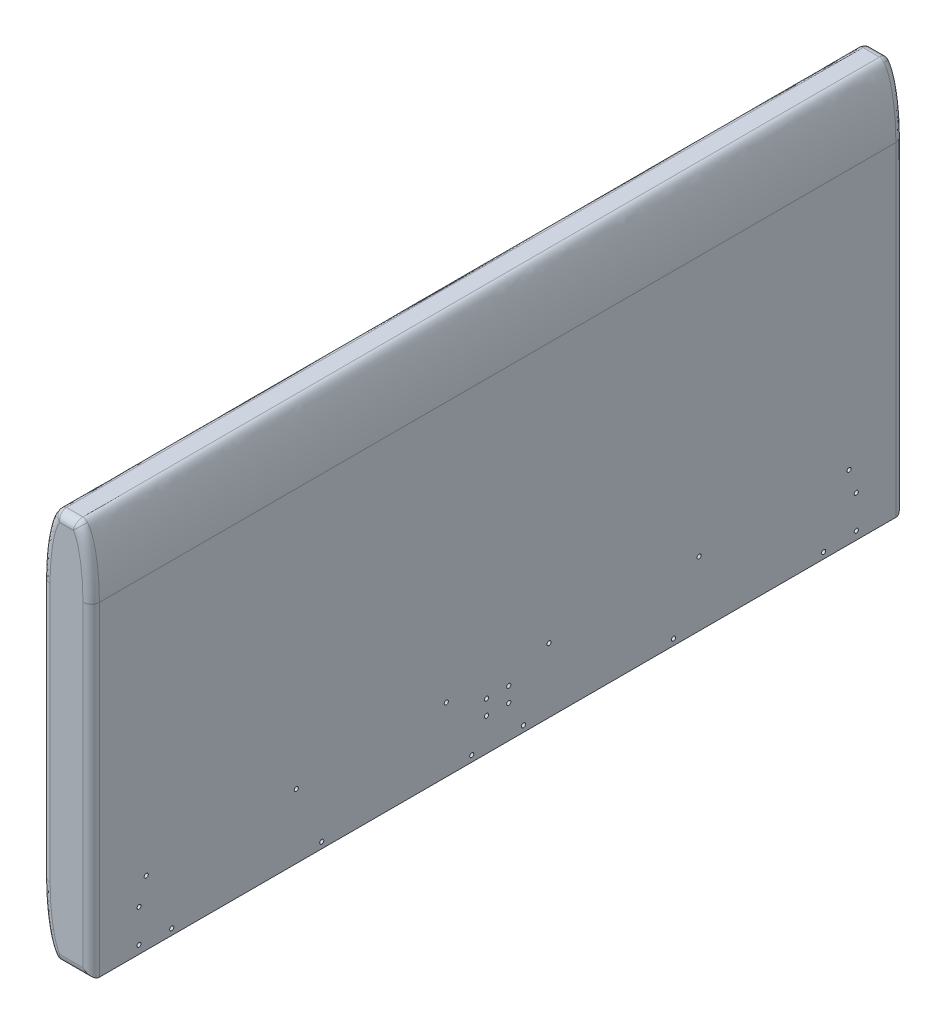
SolidWorks part; units mm, degrees
ref_plane "Спереди" through (0, 0, 0) normal (0, 0, 1) x (1, 0, 0)
ref_plane "Сверху" through (0, 0, 0) normal (0, 1, 0) x (1, 0, 0)
ref_plane "Справа" through (0, 0, 0) normal (1, 0, 0) x (0, 0, -1)
sketch "Эскиз1" plane through (0, 0, 0) normal (1, 0, 0) x (0, 0, -1)
  line L0 (-947, 120) -> (-959, 120)
  line L1 (-947, 0) -> (947, 0)
  line L2 (-947, 0) -> (-947, 80)
  line L3 (-947, 250) -> (947, 250)
  line L4 (947, 0) -> (947, 80)
  line L5 (-959, 120) -> (-959, 80)
  line L6 (-959, 80) -> (-947, 80)
  line L7 (-947, 120) -> (-947, 250)
  line L8 (0, 0) -> (0, 250) construction
  line L9 (959, 80) -> (947, 80)
  line L10 (959, 120) -> (959, 80)
  line L11 (947, 120) -> (959, 120)
  line L12 (947, 120) -> (947, 250)
  dimension "D1" = 250
  dimension "D2" = 1918
  dimension "D3" = 12
  dimension "D4" = 40
  dimension "D5" = 80
extrude "Бобышка-Вытянуть1" add sketch "Эскиз1" along normal blind 16
sketch "Эскиз4" plane through (16, 0, 0) normal (1, 0, 0) x (0, 0, -1)
  line L0 (-947, 0) -> (947, 0) construction
  line L1 (-855, 157) -> (-490, 157) construction
  line L3 (-27, 116) -> (27, 116) construction
  line L4 (-27, 116) -> (-27, 80) construction
  line L5 (-27, 80) -> (27, 80) construction
  line L6 (27, 116) -> (27, 80) construction
  line L7 (0, 0) -> (0, 80) construction
  line L8 (-490, 157) -> (-125, 157) construction
  line L9 (-125, 157) -> (125, 157) construction
  line L10 (125, 157) -> (490, 157) construction
  line L11 (490, 157) -> (855, 157) construction
  line L12 (-793, 15) -> (-947, 15) construction
  line L14 (-855, 157) -> (-947, 157) construction
  line L15 (-947, 80) -> (-947, 0) construction
  line L16 (855, 157) -> (947, 157) construction
  line L17 (947, 0) -> (947, 80) construction
  line L18 (-793, 15) -> (-428, 15) construction
  line L19 (-428, 15) -> (-63, 15) construction
  circle A6 centre (-27, 80) radius 5
  circle A7 centre (-27, 116) radius 5
  circle A8 centre (27, 116) radius 5
  circle A9 centre (27, 80) radius 5
  circle A10 centre (-490, 157) radius 5
  circle A11 centre (-855, 157) radius 5
  circle A12 centre (-125, 157) radius 5
  circle A14 centre (-872.6, 20) radius 5
  circle A15 centre (-872.6, 100) radius 5
  circle A16 centre (125, 157) radius 5
  circle A17 centre (-793, 15) radius 5
  circle A18 centre (872.6, 20) radius 5
  circle A19 centre (872.6, 100) radius 5
  circle A20 centre (-428, 15) radius 5
  circle A21 centre (-63, 15) radius 5
  circle A22 centre (490, 157) radius 5
  circle A23 centre (855, 157) radius 5
  circle A24 centre (63, 15) radius 5
  circle A25 centre (428, 15) radius 5
  circle A26 centre (793, 15) radius 5
  dimension "D1" = 80
  dimension "D2" = 36
  dimension "D3" = 54
  dimension "D4" = 10
  dimension "D5" = 250
  dimension "D11" = 80
  dimension "D12" = 1745.2
  dimension "D13" = 20
  dimension "D6" = 157
  dimension "D7" = 365
  dimension "D8" = 365
  dimension "D9" = 15
  dimension "D10" = 154
extrude "Вырез-Вытянуть3" cut sketch "Эскиз4" against normal through all
sketch "Эскиз5" plane through (16, 0, 0) normal (1, 0, 0) x (0, 0, -1)
  line L0 (0, 250) -> (0, -174.5999) construction
  line L1 (-947, 250) -> (-989, 250)
  line L2 (-947, 250) -> (-947, 0)
  line L3 (-947, 0) -> (-989, 0)
  line L4 (-989, 250) -> (-989, 0)
  line L5 (947, 250) -> (-947, 250) construction
  line L6 (989, 250) -> (989, 0)
  line L7 (947, 0) -> (989, 0)
  line L8 (947, 250) -> (947, 0)
  line L9 (947, 250) -> (989, 250)
  dimension "D1" = 42
extrude "Бобышка-Вытянуть3" add sketch "Эскиз5" against normal through all
sketch "Эскиз6" plane through (0, 0, 989) normal (0, 0, 1) x (1, 0, 0)
  line L0 (16, 250) -> (0, 250)
  line L1 (0, 250) -> (0, 0)
  line L2 (0, 0) -> (-104, 0)
  line L3 (-104, 0) -> (-104, 950)
  line L4 (-104, 950) -> (16, 950)
  line L5 (16, 950) -> (16, 250)
  dimension "D1" = 120
  dimension "D2" = 950
extrude "Бобышка-Вытянуть4" add sketch "Эскиз6" against normal through all
fillet "Скругление1" radius 40 1 edges at (16, 950, 0)
fillet "Скругление2" radius 160 1 edges at (-104, 950, 0)
fillet "Скругление3" radius 40 1 edges at (-104, 0, 0)
fillet "Скругление4" radius 20 8 edges
